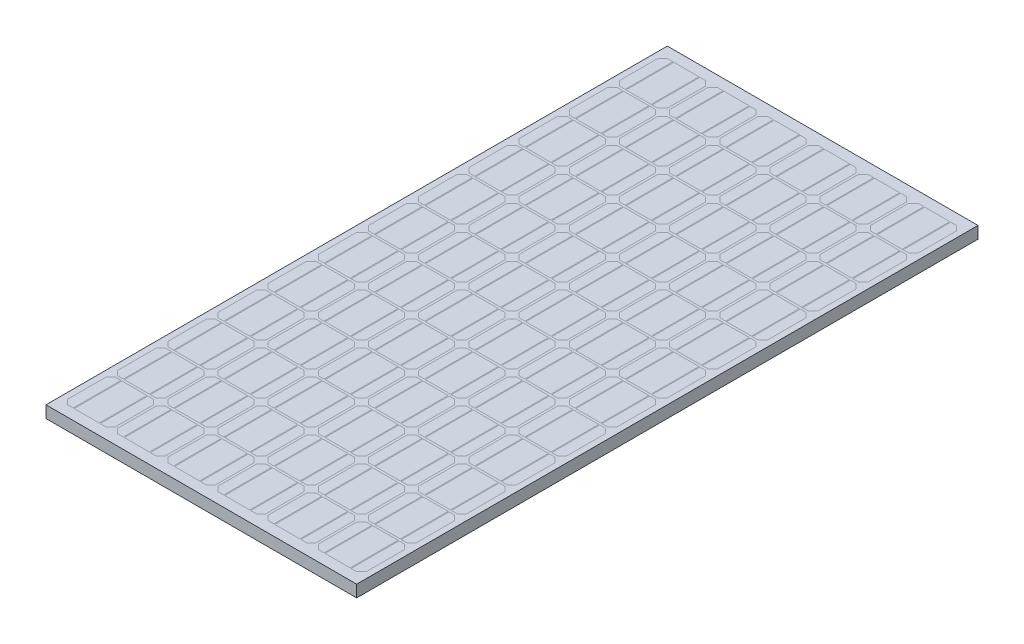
SolidWorks part; units mm, degrees
ref_plane "Front Plane" through (0, 0, 0) normal (0, 0, 1) x (1, 0, 0)
ref_plane "Top Plane" through (0, 0, 0) normal (0, 1, 0) x (1, 0, 0)
ref_plane "Right Plane" through (0, 0, 0) normal (1, 0, 0) x (0, 0, -1)
sketch "Sketch1" plane through (0, 0, 0) normal (0, 1, 0) x (1, 0, 0)
  line L1 (495.3, -990.6) -> (-495.3, -990.6)
  line L2 (495.3, -990.6) -> (495.3, 990.6)
  line L3 (495.3, 990.6) -> (-495.3, 990.6)
  line L4 (-495.3, -990.6) -> (-495.3, 990.6)
  line L5 (495.3, -990.6) -> (-495.3, 990.6) construction
  line L6 (495.3, 990.6) -> (-495.3, -990.6) construction
  point P0 (0, 0)
  dimension "D1" = 1981.2
  dimension "D2" = 990.6
extrude "Boss-Extrude1" add sketch "Sketch1" along normal blind 38.1
sketch "Sketch2" plane through (0, 38.1, 0) normal (0, 1, 0) x (1, 0, 0)
  line L0 (-495.3, 990.6) -> (-495.3, -990.6) construction
  line L1 (-461.2, 956.2) -> (-443, 956.2)
  line L2 (-476.2, 941.2) -> (-476.2, 818.8)
  line L3 (-461.2, 803.8) -> (-443, 803.8)
  line L4 (-323.8, 941.2) -> (-323.8, 818.8)
  line L5 (-476.2, 956.2) -> (-323.8, 803.8) construction
  line L6 (-476.2, 803.8) -> (-323.8, 956.2) construction
  line L7 (495.3, 990.6) -> (-495.3, 990.6) construction
  line L8 (-476.2, 941.2) -> (-461.2, 956.2)
  line L9 (-338.8, 956.2) -> (-323.8, 941.2)
  line L10 (-476.2, 818.8) -> (-461.2, 803.8)
  line L11 (-338.8, 803.8) -> (-323.8, 818.8)
  line L20 (-301.2, 956.2) -> (-283, 956.2)
  line L21 (-316.2, 941.2) -> (-316.2, 818.8)
  line L30 (-301.2, 803.8) -> (-283, 803.8)
  line L31 (-163.8, 941.2) -> (-163.8, 818.8)
  line L40 (-316.2, 941.2) -> (-301.2, 956.2)
  line L41 (-178.8, 956.2) -> (-163.8, 941.2)
  line L50 (-316.2, 818.8) -> (-301.2, 803.8)
  line L51 (-178.8, 803.8) -> (-163.8, 818.8)
  line L60 (-283, 956.2) -> (-283, 803.8)
  line L61 (-280, 956.2) -> (-280, 803.8)
  line L110 (-200, 956.2) -> (-200, 803.8)
  line L111 (-197, 956.2) -> (-197, 803.8)
  line L112 (-280, 956.2) -> (-200, 956.2)
  line L113 (-197, 956.2) -> (-178.8, 956.2)
  line L114 (-280, 803.8) -> (-200, 803.8)
  line L115 (-197, 803.8) -> (-178.8, 803.8)
  line L116 (-316.2, 956.2) -> (-163.8, 803.8) construction
  line L117 (-316.2, 803.8) -> (-163.8, 956.2) construction
  line L118 (-240, 956.2) -> (-240, 803.8) construction
  line L119 (-141.2, 956.2) -> (-123, 956.2)
  line L120 (-156.2, 941.2) -> (-156.2, 818.8)
  line L121 (-141.2, 803.8) -> (-123, 803.8)
  line L170 (-3.8, 941.2) -> (-3.8, 818.8)
  line L171 (-156.2, 941.2) -> (-141.2, 956.2)
  line L172 (-18.8, 956.2) -> (-3.8, 941.2)
  line L173 (-156.2, 818.8) -> (-141.2, 803.8)
  line L174 (-18.8, 803.8) -> (-3.8, 818.8)
  line L175 (-123, 956.2) -> (-123, 803.8)
  line L176 (-120, 956.2) -> (-120, 803.8)
  line L177 (-40, 956.2) -> (-40, 803.8)
  line L178 (-37, 956.2) -> (-37, 803.8)
  line L179 (-120, 956.2) -> (-40, 956.2)
  line L180 (-37, 956.2) -> (-18.8, 956.2)
  line L181 (-120, 803.8) -> (-40, 803.8)
  line L230 (-37, 803.8) -> (-18.8, 803.8)
  line L231 (-156.2, 956.2) -> (-3.8, 803.8) construction
  line L232 (-156.2, 803.8) -> (-3.8, 956.2) construction
  line L233 (-80, 956.2) -> (-80, 803.8) construction
  line L234 (18.8, 956.2) -> (37, 956.2)
  line L235 (3.8, 941.2) -> (3.8, 818.8)
  line L236 (18.8, 803.8) -> (37, 803.8)
  line L237 (156.2, 941.2) -> (156.2, 818.8)
  line L238 (3.8, 941.2) -> (18.8, 956.2)
  line L239 (141.2, 956.2) -> (156.2, 941.2)
  line L240 (3.8, 818.8) -> (18.8, 803.8)
  line L241 (141.2, 803.8) -> (156.2, 818.8)
  line L290 (37, 956.2) -> (37, 803.8)
  line L291 (40, 956.2) -> (40, 803.8)
  line L292 (120, 956.2) -> (120, 803.8)
  line L293 (123, 956.2) -> (123, 803.8)
  line L294 (40, 956.2) -> (120, 956.2)
  line L295 (123, 956.2) -> (141.2, 956.2)
  line L296 (40, 803.8) -> (120, 803.8)
  line L297 (123, 803.8) -> (141.2, 803.8)
  line L298 (3.8, 956.2) -> (156.2, 803.8) construction
  line L299 (3.8, 803.8) -> (156.2, 956.2) construction
  line L300 (80, 956.2) -> (80, 803.8) construction
  line L301 (178.8, 956.2) -> (197, 956.2)
  line L350 (163.8, 941.2) -> (163.8, 818.8)
  line L351 (178.8, 803.8) -> (197, 803.8)
  line L352 (316.2, 941.2) -> (316.2, 818.8)
  line L353 (163.8, 941.2) -> (178.8, 956.2)
  line L354 (301.2, 956.2) -> (316.2, 941.2)
  line L355 (163.8, 818.8) -> (178.8, 803.8)
  line L356 (301.2, 803.8) -> (316.2, 818.8)
  line L357 (197, 956.2) -> (197, 803.8)
  line L358 (200, 956.2) -> (200, 803.8)
  line L359 (280, 956.2) -> (280, 803.8)
  line L360 (283, 956.2) -> (283, 803.8)
  line L361 (200, 956.2) -> (280, 956.2)
  line L410 (283, 956.2) -> (301.2, 956.2)
  line L411 (200, 803.8) -> (280, 803.8)
  line L412 (283, 803.8) -> (301.2, 803.8)
  line L413 (163.8, 956.2) -> (316.2, 803.8) construction
  line L414 (163.8, 803.8) -> (316.2, 956.2) construction
  line L415 (240, 956.2) -> (240, 803.8) construction
  line L416 (338.8, 956.2) -> (357, 956.2)
  line L417 (323.8, 941.2) -> (323.8, 818.8)
  line L418 (338.8, 803.8) -> (357, 803.8)
  line L419 (476.2, 941.2) -> (476.2, 818.8)
  line L420 (323.8, 941.2) -> (338.8, 956.2)
  line L421 (461.2, 956.2) -> (476.2, 941.2)
  line L470 (323.8, 818.8) -> (338.8, 803.8)
  line L471 (461.2, 803.8) -> (476.2, 818.8)
  line L472 (357, 956.2) -> (357, 803.8)
  line L473 (360, 956.2) -> (360, 803.8)
  line L474 (440, 956.2) -> (440, 803.8)
  line L475 (443, 956.2) -> (443, 803.8)
  line L476 (360, 956.2) -> (440, 956.2)
  line L477 (443, 956.2) -> (461.2, 956.2)
  line L478 (360, 803.8) -> (440, 803.8)
  line L479 (443, 803.8) -> (461.2, 803.8)
  line L480 (323.8, 956.2) -> (476.2, 803.8) construction
  line L481 (323.8, 803.8) -> (476.2, 956.2) construction
  line L530 (400, 956.2) -> (400, 803.8) construction
  line L531 (-461.2, 796.2) -> (-443, 796.2)
  line L532 (-476.2, 781.2) -> (-476.2, 658.8)
  line L533 (-461.2, 643.8) -> (-443, 643.8)
  line L534 (-323.8, 781.2) -> (-323.8, 658.8)
  line L535 (-476.2, 781.2) -> (-461.2, 796.2)
  line L536 (-338.8, 796.2) -> (-323.8, 781.2)
  line L537 (-476.2, 658.8) -> (-461.2, 643.8)
  line L538 (-338.8, 643.8) -> (-323.8, 658.8)
  line L539 (-301.2, 796.2) -> (-283, 796.2)
  line L540 (-316.2, 781.2) -> (-316.2, 658.8)
  line L541 (-301.2, 643.8) -> (-283, 643.8)
  line L590 (-163.8, 781.2) -> (-163.8, 658.8)
  line L591 (-316.2, 781.2) -> (-301.2, 796.2)
  line L592 (-178.8, 796.2) -> (-163.8, 781.2)
  line L593 (-316.2, 658.8) -> (-301.2, 643.8)
  line L594 (-178.8, 643.8) -> (-163.8, 658.8)
  line L595 (-283, 796.2) -> (-283, 643.8)
  line L596 (-280, 796.2) -> (-280, 643.8)
  line L597 (-200, 796.2) -> (-200, 643.8)
  line L598 (-197, 796.2) -> (-197, 643.8)
  line L599 (-280, 796.2) -> (-200, 796.2)
  line L600 (-197, 796.2) -> (-178.8, 796.2)
  line L601 (-280, 643.8) -> (-200, 643.8)
  line L650 (-197, 643.8) -> (-178.8, 643.8)
  line L651 (-141.2, 796.2) -> (-123, 796.2)
  line L652 (-156.2, 781.2) -> (-156.2, 658.8)
  line L653 (-141.2, 643.8) -> (-123, 643.8)
  line L654 (-3.8, 781.2) -> (-3.8, 658.8)
  line L655 (-156.2, 781.2) -> (-141.2, 796.2)
  line L656 (-18.8, 796.2) -> (-3.8, 781.2)
  line L657 (-156.2, 658.8) -> (-141.2, 643.8)
  line L658 (-18.8, 643.8) -> (-3.8, 658.8)
  line L659 (-123, 796.2) -> (-123, 643.8)
  line L660 (-120, 796.2) -> (-120, 643.8)
  line L661 (-40, 796.2) -> (-40, 643.8)
  line L710 (-37, 796.2) -> (-37, 643.8)
  line L711 (-120, 796.2) -> (-40, 796.2)
  line L712 (-37, 796.2) -> (-18.8, 796.2)
  line L713 (-120, 643.8) -> (-40, 643.8)
  line L714 (-37, 643.8) -> (-18.8, 643.8)
  line L715 (18.8, 796.2) -> (37, 796.2)
  line L716 (3.8, 781.2) -> (3.8, 658.8)
  line L717 (18.8, 643.8) -> (37, 643.8)
  line L718 (156.2, 781.2) -> (156.2, 658.8)
  line L719 (3.8, 781.2) -> (18.8, 796.2)
  line L720 (141.2, 796.2) -> (156.2, 781.2)
  line L721 (3.8, 658.8) -> (18.8, 643.8)
  line L722 (-400, 956.2) -> (-400, 803.8) construction
  line L724 (-443, 956.2) -> (-443, 803.8)
  line L726 (-440, 956.2) -> (-440, 803.8)
  line L727 (-360, 956.2) -> (-360, 803.8)
  line L728 (-357, 956.2) -> (-357, 803.8)
  line L729 (-440, 956.2) -> (-360, 956.2)
  line L730 (-357, 956.2) -> (-338.8, 956.2)
  line L731 (-440, 803.8) -> (-360, 803.8)
  line L732 (-357, 803.8) -> (-338.8, 803.8)
  line L733 (141.2, 643.8) -> (156.2, 658.8)
  line L734 (37, 796.2) -> (37, 643.8)
  line L735 (40, 796.2) -> (40, 643.8)
  line L736 (120, 796.2) -> (120, 643.8)
  line L737 (123, 796.2) -> (123, 643.8)
  line L738 (40, 796.2) -> (120, 796.2)
  line L739 (123, 796.2) -> (141.2, 796.2)
  line L740 (40, 643.8) -> (120, 643.8)
  line L741 (123, 643.8) -> (141.2, 643.8)
  line L742 (178.8, 796.2) -> (197, 796.2)
  line L743 (163.8, 781.2) -> (163.8, 658.8)
  line L744 (178.8, 643.8) -> (197, 643.8)
  line L745 (316.2, 781.2) -> (316.2, 658.8)
  line L746 (163.8, 781.2) -> (178.8, 796.2)
  line L747 (301.2, 796.2) -> (316.2, 781.2)
  line L748 (163.8, 658.8) -> (178.8, 643.8)
  line L749 (301.2, 643.8) -> (316.2, 658.8)
  line L750 (197, 796.2) -> (197, 643.8)
  line L751 (200, 796.2) -> (200, 643.8)
  line L752 (280, 796.2) -> (280, 643.8)
  line L753 (283, 796.2) -> (283, 643.8)
  line L754 (200, 796.2) -> (280, 796.2)
  line L755 (283, 796.2) -> (301.2, 796.2)
  line L756 (200, 643.8) -> (280, 643.8)
  line L757 (283, 643.8) -> (301.2, 643.8)
  line L758 (338.8, 796.2) -> (357, 796.2)
  line L759 (323.8, 781.2) -> (323.8, 658.8)
  line L760 (338.8, 643.8) -> (357, 643.8)
  line L761 (476.2, 781.2) -> (476.2, 658.8)
  line L762 (323.8, 781.2) -> (338.8, 796.2)
  line L763 (461.2, 796.2) -> (476.2, 781.2)
  line L764 (323.8, 658.8) -> (338.8, 643.8)
  line L765 (461.2, 643.8) -> (476.2, 658.8)
  line L766 (357, 796.2) -> (357, 643.8)
  line L767 (360, 796.2) -> (360, 643.8)
  line L768 (440, 796.2) -> (440, 643.8)
  line L769 (443, 796.2) -> (443, 643.8)
  line L770 (360, 796.2) -> (440, 796.2)
  line L771 (443, 796.2) -> (461.2, 796.2)
  line L772 (360, 643.8) -> (440, 643.8)
  line L773 (443, 643.8) -> (461.2, 643.8)
  line L774 (-443, 796.2) -> (-443, 643.8)
  line L775 (-440, 796.2) -> (-440, 643.8)
  line L776 (-360, 796.2) -> (-360, 643.8)
  line L777 (-357, 796.2) -> (-357, 643.8)
  line L778 (-440, 796.2) -> (-360, 796.2)
  line L779 (-357, 796.2) -> (-338.8, 796.2)
  line L780 (-440, 643.8) -> (-360, 643.8)
  line L784 (-357, 643.8) -> (-338.8, 643.8)
  line L785 (-476.2, 796.2) -> (-323.8, 643.8) construction
  line L786 (-476.2, 643.8) -> (-323.8, 796.2) construction
  line L787 (-316.2, 796.2) -> (-163.8, 643.8) construction
  line L788 (-316.2, 643.8) -> (-163.8, 796.2) construction
  line L789 (-240, 796.2) -> (-240, 643.8) construction
  line L790 (-156.2, 796.2) -> (-3.8, 643.8) construction
  line L791 (-156.2, 643.8) -> (-3.8, 796.2) construction
  line L797 (-80, 796.2) -> (-80, 643.8) construction
  line L798 (3.8, 796.2) -> (156.2, 643.8) construction
  line L799 (3.8, 643.8) -> (156.2, 796.2) construction
  line L800 (80, 796.2) -> (80, 643.8) construction
  line L801 (163.8, 796.2) -> (316.2, 643.8) construction
  line L802 (163.8, 643.8) -> (316.2, 796.2) construction
  line L803 (240, 796.2) -> (240, 643.8) construction
  line L804 (323.8, 796.2) -> (476.2, 643.8) construction
  line L810 (323.8, 643.8) -> (476.2, 796.2) construction
  line L811 (400, 796.2) -> (400, 643.8) construction
  line L812 (-400, 796.2) -> (-400, 643.8) construction
  line L813 (-461.2, 636.2) -> (-443, 636.2)
  line L814 (-476.2, 621.2) -> (-476.2, 498.8)
  line L815 (-461.2, 483.8) -> (-443, 483.8)
  line L816 (-323.8, 621.2) -> (-323.8, 498.8)
  line L817 (-476.2, 621.2) -> (-461.2, 636.2)
  line L823 (-338.8, 636.2) -> (-323.8, 621.2)
  line L824 (-476.2, 498.8) -> (-461.2, 483.8)
  line L825 (-338.8, 483.8) -> (-323.8, 498.8)
  line L826 (-301.2, 636.2) -> (-283, 636.2)
  line L827 (-316.2, 621.2) -> (-316.2, 498.8)
  line L828 (-301.2, 483.8) -> (-283, 483.8)
  line L829 (-163.8, 621.2) -> (-163.8, 498.8)
  line L830 (-316.2, 621.2) -> (-301.2, 636.2)
  line L836 (-178.8, 636.2) -> (-163.8, 621.2)
  line L837 (-316.2, 498.8) -> (-301.2, 483.8)
  line L838 (-178.8, 483.8) -> (-163.8, 498.8)
  line L839 (-283, 636.2) -> (-283, 483.8)
  line L840 (-280, 636.2) -> (-280, 483.8)
  line L841 (-200, 636.2) -> (-200, 483.8)
  line L842 (-197, 636.2) -> (-197, 483.8)
  line L843 (-280, 636.2) -> (-200, 636.2)
  line L849 (-197, 636.2) -> (-178.8, 636.2)
  line L850 (-280, 483.8) -> (-200, 483.8)
  line L851 (-197, 483.8) -> (-178.8, 483.8)
  line L852 (-141.2, 636.2) -> (-123, 636.2)
  line L853 (-156.2, 621.2) -> (-156.2, 498.8)
  line L854 (-141.2, 483.8) -> (-123, 483.8)
  line L855 (-3.8, 621.2) -> (-3.8, 498.8)
  line L856 (-156.2, 621.2) -> (-141.2, 636.2)
  line L862 (-18.8, 636.2) -> (-3.8, 621.2)
  line L863 (-156.2, 498.8) -> (-141.2, 483.8)
  line L864 (-18.8, 483.8) -> (-3.8, 498.8)
  line L865 (-123, 636.2) -> (-123, 483.8)
  line L866 (-120, 636.2) -> (-120, 483.8)
  line L867 (-40, 636.2) -> (-40, 483.8)
  line L868 (-37, 636.2) -> (-37, 483.8)
  line L869 (-120, 636.2) -> (-40, 636.2)
  line L875 (-37, 636.2) -> (-18.8, 636.2)
  line L876 (-120, 483.8) -> (-40, 483.8)
  line L877 (-37, 483.8) -> (-18.8, 483.8)
  line L878 (18.8, 636.2) -> (37, 636.2)
  line L879 (3.8, 621.2) -> (3.8, 498.8)
  line L880 (18.8, 483.8) -> (37, 483.8)
  line L881 (156.2, 621.2) -> (156.2, 498.8)
  line L882 (3.8, 621.2) -> (18.8, 636.2)
  line L888 (141.2, 636.2) -> (156.2, 621.2)
  line L889 (3.8, 498.8) -> (18.8, 483.8)
  line L890 (141.2, 483.8) -> (156.2, 498.8)
  line L891 (37, 636.2) -> (37, 483.8)
  line L892 (40, 636.2) -> (40, 483.8)
  line L893 (120, 636.2) -> (120, 483.8)
  line L894 (123, 636.2) -> (123, 483.8)
  line L895 (40, 636.2) -> (120, 636.2)
  line L901 (123, 636.2) -> (141.2, 636.2)
  line L902 (40, 483.8) -> (120, 483.8)
  line L903 (123, 483.8) -> (141.2, 483.8)
  line L904 (178.8, 636.2) -> (197, 636.2)
  line L905 (163.8, 621.2) -> (163.8, 498.8)
  line L906 (178.8, 483.8) -> (197, 483.8)
  line L907 (316.2, 621.2) -> (316.2, 498.8)
  line L908 (163.8, 621.2) -> (178.8, 636.2)
  line L914 (301.2, 636.2) -> (316.2, 621.2)
  line L915 (163.8, 498.8) -> (178.8, 483.8)
  line L918 (301.2, 483.8) -> (316.2, 498.8)
  line L919 (197, 636.2) -> (197, 483.8)
  line L922 (200, 636.2) -> (200, 483.8)
  line L923 (280, 636.2) -> (280, 483.8)
  line L926 (283, 636.2) -> (283, 483.8)
  line L927 (200, 636.2) -> (280, 636.2)
  line L930 (283, 636.2) -> (301.2, 636.2)
  line L931 (200, 483.8) -> (280, 483.8)
  line L934 (283, 483.8) -> (301.2, 483.8)
  line L935 (338.8, 636.2) -> (357, 636.2)
  line L938 (323.8, 621.2) -> (323.8, 498.8)
  line L939 (338.8, 483.8) -> (357, 483.8)
  line L942 (476.2, 621.2) -> (476.2, 498.8)
  line L943 (323.8, 621.2) -> (338.8, 636.2)
  line L946 (461.2, 636.2) -> (476.2, 621.2)
  line L947 (323.8, 498.8) -> (338.8, 483.8)
  line L950 (461.2, 483.8) -> (476.2, 498.8)
  line L951 (357, 636.2) -> (357, 483.8)
  line L954 (360, 636.2) -> (360, 483.8)
  line L955 (440, 636.2) -> (440, 483.8)
  line L958 (443, 636.2) -> (443, 483.8)
  line L959 (360, 636.2) -> (440, 636.2)
  line L960 (443, 636.2) -> (461.2, 636.2)
  line L961 (360, 483.8) -> (440, 483.8)
  line L962 (443, 483.8) -> (461.2, 483.8)
  line L963 (-443, 636.2) -> (-443, 483.8)
  line L964 (-440, 636.2) -> (-440, 483.8)
  line L965 (-360, 636.2) -> (-360, 483.8)
  line L966 (-357, 636.2) -> (-357, 483.8)
  line L967 (-440, 636.2) -> (-360, 636.2)
  line L968 (-357, 636.2) -> (-338.8, 636.2)
  line L969 (-440, 483.8) -> (-360, 483.8)
  line L970 (-357, 483.8) -> (-338.8, 483.8)
  line L971 (-476.2, 636.2) -> (-323.8, 483.8) construction
  line L972 (-476.2, 483.8) -> (-323.8, 636.2) construction
  line L973 (-316.2, 636.2) -> (-163.8, 483.8) construction
  line L974 (-316.2, 483.8) -> (-163.8, 636.2) construction
  line L975 (-240, 636.2) -> (-240, 483.8) construction
  line L976 (-156.2, 636.2) -> (-3.8, 483.8) construction
  line L977 (-156.2, 483.8) -> (-3.8, 636.2) construction
  line L978 (-80, 636.2) -> (-80, 483.8) construction
  line L979 (3.8, 636.2) -> (156.2, 483.8) construction
  line L980 (3.8, 483.8) -> (156.2, 636.2) construction
  line L981 (80, 636.2) -> (80, 483.8) construction
  line L982 (163.8, 636.2) -> (316.2, 483.8) construction
  line L983 (163.8, 483.8) -> (316.2, 636.2) construction
  line L984 (240, 636.2) -> (240, 483.8) construction
  line L985 (323.8, 636.2) -> (476.2, 483.8) construction
  line L986 (323.8, 483.8) -> (476.2, 636.2) construction
  line L987 (400, 636.2) -> (400, 483.8) construction
  line L988 (-400, 636.2) -> (-400, 483.8) construction
  line L989 (-461.2, 476.2) -> (-443, 476.2)
  line L990 (-476.2, 461.2) -> (-476.2, 338.8)
  line L991 (-461.2, 323.8) -> (-443, 323.8)
  line L992 (-323.8, 461.2) -> (-323.8, 338.8)
  line L993 (-476.2, 461.2) -> (-461.2, 476.2)
  line L994 (-338.8, 476.2) -> (-323.8, 461.2)
  line L995 (-476.2, 338.8) -> (-461.2, 323.8)
  line L996 (-338.8, 323.8) -> (-323.8, 338.8)
  line L997 (-301.2, 476.2) -> (-283, 476.2)
  line L998 (-316.2, 461.2) -> (-316.2, 338.8)
  line L999 (-301.2, 323.8) -> (-283, 323.8)
  line L1000 (-163.8, 461.2) -> (-163.8, 338.8)
  line L1001 (-316.2, 461.2) -> (-301.2, 476.2)
  line L1002 (-178.8, 476.2) -> (-163.8, 461.2)
  line L1003 (-316.2, 338.8) -> (-301.2, 323.8)
  line L1004 (-178.8, 323.8) -> (-163.8, 338.8)
  line L1005 (-283, 476.2) -> (-283, 323.8)
  line L1006 (-280, 476.2) -> (-280, 323.8)
  line L1007 (-200, 476.2) -> (-200, 323.8)
  line L1008 (-197, 476.2) -> (-197, 323.8)
  line L1009 (-280, 476.2) -> (-200, 476.2)
  line L1010 (-197, 476.2) -> (-178.8, 476.2)
  line L1011 (-280, 323.8) -> (-200, 323.8)
  line L1012 (-197, 323.8) -> (-178.8, 323.8)
  line L1013 (-141.2, 476.2) -> (-123, 476.2)
  line L1014 (-156.2, 461.2) -> (-156.2, 338.8)
  line L1015 (-141.2, 323.8) -> (-123, 323.8)
  line L1016 (-3.8, 461.2) -> (-3.8, 338.8)
  line L1017 (-156.2, 461.2) -> (-141.2, 476.2)
  line L1018 (-18.8, 476.2) -> (-3.8, 461.2)
  line L1019 (-156.2, 338.8) -> (-141.2, 323.8)
  line L1020 (-18.8, 323.8) -> (-3.8, 338.8)
  line L1021 (-123, 476.2) -> (-123, 323.8)
  line L1022 (-120, 476.2) -> (-120, 323.8)
  line L1023 (-40, 476.2) -> (-40, 323.8)
  line L1024 (-37, 476.2) -> (-37, 323.8)
  line L1025 (-120, 476.2) -> (-40, 476.2)
  line L1026 (-37, 476.2) -> (-18.8, 476.2)
  line L1027 (-120, 323.8) -> (-40, 323.8)
  line L1028 (-37, 323.8) -> (-18.8, 323.8)
  line L1029 (18.8, 476.2) -> (37, 476.2)
  line L1030 (3.8, 461.2) -> (3.8, 338.8)
  line L1031 (18.8, 323.8) -> (37, 323.8)
  line L1032 (156.2, 461.2) -> (156.2, 338.8)
  line L1033 (3.8, 461.2) -> (18.8, 476.2)
  line L1034 (141.2, 476.2) -> (156.2, 461.2)
  line L1035 (3.8, 338.8) -> (18.8, 323.8)
  line L1036 (141.2, 323.8) -> (156.2, 338.8)
  line L1037 (37, 476.2) -> (37, 323.8)
  line L1038 (40, 476.2) -> (40, 323.8)
  line L1039 (120, 476.2) -> (120, 323.8)
  line L1040 (123, 476.2) -> (123, 323.8)
  line L1041 (40, 476.2) -> (120, 476.2)
  line L1042 (123, 476.2) -> (141.2, 476.2)
  line L1043 (40, 323.8) -> (120, 323.8)
  line L1044 (123, 323.8) -> (141.2, 323.8)
  line L1045 (178.8, 476.2) -> (197, 476.2)
  line L1046 (163.8, 461.2) -> (163.8, 338.8)
  line L1047 (178.8, 323.8) -> (197, 323.8)
  line L1048 (316.2, 461.2) -> (316.2, 338.8)
  line L1049 (163.8, 461.2) -> (178.8, 476.2)
  line L1050 (301.2, 476.2) -> (316.2, 461.2)
  line L1051 (163.8, 338.8) -> (178.8, 323.8)
  line L1052 (301.2, 323.8) -> (316.2, 338.8)
  line L1053 (197, 476.2) -> (197, 323.8)
  line L1054 (200, 476.2) -> (200, 323.8)
  line L1055 (280, 476.2) -> (280, 323.8)
  line L1056 (283, 476.2) -> (283, 323.8)
  line L1057 (200, 476.2) -> (280, 476.2)
  line L1058 (283, 476.2) -> (301.2, 476.2)
  line L1059 (200, 323.8) -> (280, 323.8)
  line L1060 (283, 323.8) -> (301.2, 323.8)
  line L1061 (338.8, 476.2) -> (357, 476.2)
  line L1062 (323.8, 461.2) -> (323.8, 338.8)
  line L1063 (338.8, 323.8) -> (357, 323.8)
  line L1064 (476.2, 461.2) -> (476.2, 338.8)
  line L1065 (323.8, 461.2) -> (338.8, 476.2)
  line L1066 (461.2, 476.2) -> (476.2, 461.2)
  line L1067 (323.8, 338.8) -> (338.8, 323.8)
  line L1068 (461.2, 323.8) -> (476.2, 338.8)
  line L1069 (357, 476.2) -> (357, 323.8)
  line L1070 (360, 476.2) -> (360, 323.8)
  line L1071 (440, 476.2) -> (440, 323.8)
  line L1072 (443, 476.2) -> (443, 323.8)
  line L1073 (360, 476.2) -> (440, 476.2)
  line L1074 (443, 476.2) -> (461.2, 476.2)
  line L1075 (360, 323.8) -> (440, 323.8)
  line L1076 (443, 323.8) -> (461.2, 323.8)
  line L1077 (-443, 476.2) -> (-443, 323.8)
  line L1078 (-440, 476.2) -> (-440, 323.8)
  line L1079 (-360, 476.2) -> (-360, 323.8)
  line L1080 (-357, 476.2) -> (-357, 323.8)
  line L1081 (-440, 476.2) -> (-360, 476.2)
  line L1082 (-357, 476.2) -> (-338.8, 476.2)
  line L1083 (-440, 323.8) -> (-360, 323.8)
  line L1084 (-357, 323.8) -> (-338.8, 323.8)
  line L1085 (-476.2, 476.2) -> (-323.8, 323.8) construction
  line L1086 (-476.2, 323.8) -> (-323.8, 476.2) construction
  line L1087 (-316.2, 476.2) -> (-163.8, 323.8) construction
  line L1088 (-316.2, 323.8) -> (-163.8, 476.2) construction
  line L1089 (-240, 476.2) -> (-240, 323.8) construction
  line L1090 (-156.2, 476.2) -> (-3.8, 323.8) construction
  line L1091 (-156.2, 323.8) -> (-3.8, 476.2) construction
  line L1092 (-80, 476.2) -> (-80, 323.8) construction
  line L1093 (3.8, 476.2) -> (156.2, 323.8) construction
  line L1094 (3.8, 323.8) -> (156.2, 476.2) construction
  line L1095 (80, 476.2) -> (80, 323.8) construction
  line L1096 (163.8, 476.2) -> (316.2, 323.8) construction
  line L1097 (163.8, 323.8) -> (316.2, 476.2) construction
  line L1098 (240, 476.2) -> (240, 323.8) construction
  line L1099 (323.8, 476.2) -> (476.2, 323.8) construction
  line L1100 (323.8, 323.8) -> (476.2, 476.2) construction
  line L1101 (400, 476.2) -> (400, 323.8) construction
  line L1102 (-400, 476.2) -> (-400, 323.8) construction
  line L1103 (-461.2, 316.2) -> (-443, 316.2)
  line L1104 (-476.2, 301.2) -> (-476.2, 178.8)
  line L1105 (-461.2, 163.8) -> (-443, 163.8)
  line L1106 (-323.8, 301.2) -> (-323.8, 178.8)
  line L1107 (-476.2, 301.2) -> (-461.2, 316.2)
  line L1108 (-338.8, 316.2) -> (-323.8, 301.2)
  line L1109 (-476.2, 178.8) -> (-461.2, 163.8)
  line L1110 (-338.8, 163.8) -> (-323.8, 178.8)
  line L1111 (-301.2, 316.2) -> (-283, 316.2)
  line L1112 (-316.2, 301.2) -> (-316.2, 178.8)
  line L1113 (-301.2, 163.8) -> (-283, 163.8)
  line L1114 (-163.8, 301.2) -> (-163.8, 178.8)
  line L1115 (-316.2, 301.2) -> (-301.2, 316.2)
  line L1116 (-178.8, 316.2) -> (-163.8, 301.2)
  line L1117 (-316.2, 178.8) -> (-301.2, 163.8)
  line L1118 (-178.8, 163.8) -> (-163.8, 178.8)
  line L1119 (-283, 316.2) -> (-283, 163.8)
  line L1120 (-280, 316.2) -> (-280, 163.8)
  line L1121 (-200, 316.2) -> (-200, 163.8)
  line L1122 (-197, 316.2) -> (-197, 163.8)
  line L1123 (-280, 316.2) -> (-200, 316.2)
  line L1124 (-197, 316.2) -> (-178.8, 316.2)
  line L1125 (-280, 163.8) -> (-200, 163.8)
  line L1126 (-197, 163.8) -> (-178.8, 163.8)
  line L1127 (-141.2, 316.2) -> (-123, 316.2)
  line L1128 (-156.2, 301.2) -> (-156.2, 178.8)
  line L1129 (-141.2, 163.8) -> (-123, 163.8)
  line L1130 (-3.8, 301.2) -> (-3.8, 178.8)
  line L1131 (-156.2, 301.2) -> (-141.2, 316.2)
  line L1132 (-18.8, 316.2) -> (-3.8, 301.2)
  line L1133 (-156.2, 178.8) -> (-141.2, 163.8)
  line L1134 (-18.8, 163.8) -> (-3.8, 178.8)
  line L1135 (-123, 316.2) -> (-123, 163.8)
  line L1136 (-120, 316.2) -> (-120, 163.8)
  line L1137 (-40, 316.2) -> (-40, 163.8)
  line L1138 (-37, 316.2) -> (-37, 163.8)
  line L1139 (-120, 316.2) -> (-40, 316.2)
  line L1140 (-37, 316.2) -> (-18.8, 316.2)
  line L1141 (-120, 163.8) -> (-40, 163.8)
  line L1142 (-37, 163.8) -> (-18.8, 163.8)
  line L1143 (18.8, 316.2) -> (37, 316.2)
  line L1144 (3.8, 301.2) -> (3.8, 178.8)
  line L1145 (18.8, 163.8) -> (37, 163.8)
  line L1146 (156.2, 301.2) -> (156.2, 178.8)
  line L1147 (3.8, 301.2) -> (18.8, 316.2)
  line L1148 (141.2, 316.2) -> (156.2, 301.2)
  line L1149 (3.8, 178.8) -> (18.8, 163.8)
  line L1150 (141.2, 163.8) -> (156.2, 178.8)
  line L1151 (37, 316.2) -> (37, 163.8)
  line L1152 (40, 316.2) -> (40, 163.8)
  line L1153 (120, 316.2) -> (120, 163.8)
  line L1154 (123, 316.2) -> (123, 163.8)
  line L1155 (40, 316.2) -> (120, 316.2)
  line L1156 (123, 316.2) -> (141.2, 316.2)
  line L1157 (40, 163.8) -> (120, 163.8)
  line L1158 (123, 163.8) -> (141.2, 163.8)
  line L1159 (178.8, 316.2) -> (197, 316.2)
  line L1160 (163.8, 301.2) -> (163.8, 178.8)
  line L1161 (178.8, 163.8) -> (197, 163.8)
  line L1162 (316.2, 301.2) -> (316.2, 178.8)
  line L1163 (163.8, 301.2) -> (178.8, 316.2)
  line L1164 (301.2, 316.2) -> (316.2, 301.2)
  line L1165 (163.8, 178.8) -> (178.8, 163.8)
  line L1166 (301.2, 163.8) -> (316.2, 178.8)
  line L1167 (197, 316.2) -> (197, 163.8)
  line L1168 (200, 316.2) -> (200, 163.8)
  line L1169 (280, 316.2) -> (280, 163.8)
  line L1170 (283, 316.2) -> (283, 163.8)
  line L1171 (200, 316.2) -> (280, 316.2)
  line L1172 (283, 316.2) -> (301.2, 316.2)
  line L1173 (200, 163.8) -> (280, 163.8)
  line L1174 (283, 163.8) -> (301.2, 163.8)
  line L1175 (338.8, 316.2) -> (357, 316.2)
  line L1176 (323.8, 301.2) -> (323.8, 178.8)
  line L1177 (338.8, 163.8) -> (357, 163.8)
  line L1178 (476.2, 301.2) -> (476.2, 178.8)
  line L1179 (323.8, 301.2) -> (338.8, 316.2)
  line L1180 (461.2, 316.2) -> (476.2, 301.2)
  line L1181 (323.8, 178.8) -> (338.8, 163.8)
  line L1182 (461.2, 163.8) -> (476.2, 178.8)
  line L1183 (357, 316.2) -> (357, 163.8)
  line L1184 (360, 316.2) -> (360, 163.8)
  line L1185 (440, 316.2) -> (440, 163.8)
  line L1186 (443, 316.2) -> (443, 163.8)
  line L1187 (360, 316.2) -> (440, 316.2)
  line L1188 (443, 316.2) -> (461.2, 316.2)
  line L1189 (360, 163.8) -> (440, 163.8)
  line L1190 (443, 163.8) -> (461.2, 163.8)
  line L1191 (-443, 316.2) -> (-443, 163.8)
  line L1192 (-440, 316.2) -> (-440, 163.8)
  line L1193 (-360, 316.2) -> (-360, 163.8)
  line L1194 (-357, 316.2) -> (-357, 163.8)
  line L1195 (-440, 316.2) -> (-360, 316.2)
  line L1196 (-357, 316.2) -> (-338.8, 316.2)
  line L1197 (-440, 163.8) -> (-360, 163.8)
  line L1198 (-357, 163.8) -> (-338.8, 163.8)
  line L1199 (-476.2, 316.2) -> (-323.8, 163.8) construction
  line L1200 (-476.2, 163.8) -> (-323.8, 316.2) construction
  line L1201 (-316.2, 316.2) -> (-163.8, 163.8) construction
  line L1202 (-316.2, 163.8) -> (-163.8, 316.2) construction
  line L1203 (-240, 316.2) -> (-240, 163.8) construction
  line L1204 (-156.2, 316.2) -> (-3.8, 163.8) construction
  line L1205 (-156.2, 163.8) -> (-3.8, 316.2) construction
  line L1206 (-80, 316.2) -> (-80, 163.8) construction
  line L1207 (3.8, 316.2) -> (156.2, 163.8) construction
  line L1208 (3.8, 163.8) -> (156.2, 316.2) construction
  line L1209 (80, 316.2) -> (80, 163.8) construction
  line L1210 (163.8, 316.2) -> (316.2, 163.8) construction
  line L1211 (163.8, 163.8) -> (316.2, 316.2) construction
  line L1212 (240, 316.2) -> (240, 163.8) construction
  line L1213 (323.8, 316.2) -> (476.2, 163.8) construction
  line L1214 (323.8, 163.8) -> (476.2, 316.2) construction
  line L1215 (400, 316.2) -> (400, 163.8) construction
  line L1216 (-400, 316.2) -> (-400, 163.8) construction
  line L1217 (-461.2, 156.2) -> (-443, 156.2)
  line L1218 (-476.2, 141.2) -> (-476.2, 18.8)
  line L1219 (-461.2, 3.8) -> (-443, 3.8)
  line L1220 (-323.8, 141.2) -> (-323.8, 18.8)
  line L1221 (-476.2, 141.2) -> (-461.2, 156.2)
  line L1222 (-338.8, 156.2) -> (-323.8, 141.2)
  line L1223 (-476.2, 18.8) -> (-461.2, 3.8)
  line L1224 (-338.8, 3.8) -> (-323.8, 18.8)
  line L1225 (-301.2, 156.2) -> (-283, 156.2)
  line L1226 (-316.2, 141.2) -> (-316.2, 18.8)
  line L1227 (-301.2, 3.8) -> (-283, 3.8)
  line L1228 (-163.8, 141.2) -> (-163.8, 18.8)
  line L1229 (-316.2, 141.2) -> (-301.2, 156.2)
  line L1230 (-178.8, 156.2) -> (-163.8, 141.2)
  line L1231 (-316.2, 18.8) -> (-301.2, 3.8)
  line L1232 (-178.8, 3.8) -> (-163.8, 18.8)
  line L1233 (-283, 156.2) -> (-283, 3.8)
  line L1234 (-280, 156.2) -> (-280, 3.8)
  line L1235 (-200, 156.2) -> (-200, 3.8)
  line L1236 (-197, 156.2) -> (-197, 3.8)
  line L1237 (-280, 156.2) -> (-200, 156.2)
  line L1238 (-197, 156.2) -> (-178.8, 156.2)
  line L1239 (-280, 3.8) -> (-200, 3.8)
  line L1240 (-197, 3.8) -> (-178.8, 3.8)
  line L1241 (-141.2, 156.2) -> (-123, 156.2)
  line L1242 (-156.2, 141.2) -> (-156.2, 18.8)
  line L1243 (-141.2, 3.8) -> (-123, 3.8)
  line L1244 (-3.8, 141.2) -> (-3.8, 18.8)
  line L1245 (-156.2, 141.2) -> (-141.2, 156.2)
  line L1246 (-18.8, 156.2) -> (-3.8, 141.2)
  line L1247 (-156.2, 18.8) -> (-141.2, 3.8)
  line L1248 (-18.8, 3.8) -> (-3.8, 18.8)
  line L1249 (-123, 156.2) -> (-123, 3.8)
  line L1250 (-120, 156.2) -> (-120, 3.8)
  line L1251 (-40, 156.2) -> (-40, 3.8)
  line L1252 (-37, 156.2) -> (-37, 3.8)
  line L1253 (-120, 156.2) -> (-40, 156.2)
  line L1254 (-37, 156.2) -> (-18.8, 156.2)
  line L1255 (-120, 3.8) -> (-40, 3.8)
  line L1256 (-37, 3.8) -> (-18.8, 3.8)
  line L1257 (18.8, 156.2) -> (37, 156.2)
  line L1258 (3.8, 141.2) -> (3.8, 18.8)
  line L1259 (18.8, 3.8) -> (37, 3.8)
  line L1260 (156.2, 141.2) -> (156.2, 18.8)
  line L1261 (3.8, 141.2) -> (18.8, 156.2)
  line L1262 (141.2, 156.2) -> (156.2, 141.2)
  line L1263 (3.8, 18.8) -> (18.8, 3.8)
  line L1264 (141.2, 3.8) -> (156.2, 18.8)
  line L1265 (37, 156.2) -> (37, 3.8)
  line L1266 (40, 156.2) -> (40, 3.8)
  line L1267 (120, 156.2) -> (120, 3.8)
  line L1268 (123, 156.2) -> (123, 3.8)
  line L1269 (40, 156.2) -> (120, 156.2)
  line L1270 (123, 156.2) -> (141.2, 156.2)
  line L1271 (40, 3.8) -> (120, 3.8)
  line L1272 (123, 3.8) -> (141.2, 3.8)
  line L1273 (178.8, 156.2) -> (197, 156.2)
  line L1274 (163.8, 141.2) -> (163.8, 18.8)
  line L1275 (178.8, 3.8) -> (197, 3.8)
  line L1276 (316.2, 141.2) -> (316.2, 18.8)
  line L1277 (163.8, 141.2) -> (178.8, 156.2)
  line L1278 (301.2, 156.2) -> (316.2, 141.2)
  line L1279 (163.8, 18.8) -> (178.8, 3.8)
  line L1280 (301.2, 3.8) -> (316.2, 18.8)
  line L1281 (197, 156.2) -> (197, 3.8)
  line L1282 (200, 156.2) -> (200, 3.8)
  line L1283 (280, 156.2) -> (280, 3.8)
  line L1284 (283, 156.2) -> (283, 3.8)
  line L1285 (200, 156.2) -> (280, 156.2)
  line L1286 (283, 156.2) -> (301.2, 156.2)
  line L1287 (200, 3.8) -> (280, 3.8)
  line L1288 (283, 3.8) -> (301.2, 3.8)
  line L1289 (338.8, 156.2) -> (357, 156.2)
  line L1290 (323.8, 141.2) -> (323.8, 18.8)
  line L1291 (338.8, 3.8) -> (357, 3.8)
  line L1292 (476.2, 141.2) -> (476.2, 18.8)
  line L1293 (323.8, 141.2) -> (338.8, 156.2)
  line L1294 (461.2, 156.2) -> (476.2, 141.2)
  line L1295 (323.8, 18.8) -> (338.8, 3.8)
  line L1296 (461.2, 3.8) -> (476.2, 18.8)
  line L1297 (357, 156.2) -> (357, 3.8)
  line L1298 (360, 156.2) -> (360, 3.8)
  line L1299 (440, 156.2) -> (440, 3.8)
  line L1300 (443, 156.2) -> (443, 3.8)
  line L1301 (360, 156.2) -> (440, 156.2)
  line L1302 (443, 156.2) -> (461.2, 156.2)
  line L1303 (360, 3.8) -> (440, 3.8)
  line L1304 (443, 3.8) -> (461.2, 3.8)
  line L1305 (-443, 156.2) -> (-443, 3.8)
  line L1306 (-440, 156.2) -> (-440, 3.8)
  line L1307 (-360, 156.2) -> (-360, 3.8)
  line L1308 (-357, 156.2) -> (-357, 3.8)
  line L1309 (-440, 156.2) -> (-360, 156.2)
  line L1310 (-357, 156.2) -> (-338.8, 156.2)
  line L1311 (-440, 3.8) -> (-360, 3.8)
  line L1312 (-357, 3.8) -> (-338.8, 3.8)
  line L1313 (-476.2, 156.2) -> (-323.8, 3.8) construction
  line L1314 (-476.2, 3.8) -> (-323.8, 156.2) construction
  line L1315 (-316.2, 156.2) -> (-163.8, 3.8) construction
  line L1316 (-316.2, 3.8) -> (-163.8, 156.2) construction
  line L1317 (-240, 156.2) -> (-240, 3.8) construction
  line L1318 (-156.2, 156.2) -> (-3.8, 3.8) construction
  line L1319 (-156.2, 3.8) -> (-3.8, 156.2) construction
  line L1320 (-80, 156.2) -> (-80, 3.8) construction
  line L1321 (3.8, 156.2) -> (156.2, 3.8) construction
  line L1322 (3.8, 3.8) -> (156.2, 156.2) construction
  line L1323 (80, 156.2) -> (80, 3.8) construction
  line L1324 (163.8, 156.2) -> (316.2, 3.8) construction
  line L1325 (163.8, 3.8) -> (316.2, 156.2) construction
  line L1326 (240, 156.2) -> (240, 3.8) construction
  line L1327 (323.8, 156.2) -> (476.2, 3.8) construction
  line L1328 (323.8, 3.8) -> (476.2, 156.2) construction
  line L1329 (400, 156.2) -> (400, 3.8) construction
  line L1330 (-400, 156.2) -> (-400, 3.8) construction
  line L1331 (-461.2, -3.8) -> (-443, -3.8)
  line L1332 (-476.2, -18.8) -> (-476.2, -141.2)
  line L1333 (-461.2, -156.2) -> (-443, -156.2)
  line L1334 (-323.8, -18.8) -> (-323.8, -141.2)
  line L1335 (-476.2, -18.8) -> (-461.2, -3.8)
  line L1336 (-338.8, -3.8) -> (-323.8, -18.8)
  line L1337 (-476.2, -141.2) -> (-461.2, -156.2)
  line L1338 (-338.8, -156.2) -> (-323.8, -141.2)
  line L1339 (-301.2, -3.8) -> (-283, -3.8)
  line L1340 (-316.2, -18.8) -> (-316.2, -141.2)
  line L1341 (-301.2, -156.2) -> (-283, -156.2)
  line L1342 (-163.8, -18.8) -> (-163.8, -141.2)
  line L1343 (-316.2, -18.8) -> (-301.2, -3.8)
  line L1344 (-178.8, -3.8) -> (-163.8, -18.8)
  line L1345 (-316.2, -141.2) -> (-301.2, -156.2)
  line L1346 (-178.8, -156.2) -> (-163.8, -141.2)
  line L1347 (-283, -3.8) -> (-283, -156.2)
  line L1348 (-280, -3.8) -> (-280, -156.2)
  line L1349 (-200, -3.8) -> (-200, -156.2)
  line L1350 (-197, -3.8) -> (-197, -156.2)
  line L1351 (-280, -3.8) -> (-200, -3.8)
  line L1352 (-197, -3.8) -> (-178.8, -3.8)
  line L1353 (-280, -156.2) -> (-200, -156.2)
  line L1354 (-197, -156.2) -> (-178.8, -156.2)
  line L1355 (-141.2, -3.8) -> (-123, -3.8)
  line L1356 (-156.2, -18.8) -> (-156.2, -141.2)
  line L1357 (-141.2, -156.2) -> (-123, -156.2)
  line L1358 (-3.8, -18.8) -> (-3.8, -141.2)
  line L1359 (-156.2, -18.8) -> (-141.2, -3.8)
  line L1360 (-18.8, -3.8) -> (-3.8, -18.8)
  line L1361 (-156.2, -141.2) -> (-141.2, -156.2)
  line L1362 (-18.8, -156.2) -> (-3.8, -141.2)
  line L1363 (-123, -3.8) -> (-123, -156.2)
  line L1364 (-120, -3.8) -> (-120, -156.2)
  line L1365 (-40, -3.8) -> (-40, -156.2)
  line L1366 (-37, -3.8) -> (-37, -156.2)
  line L1367 (-120, -3.8) -> (-40, -3.8)
  line L1368 (-37, -3.8) -> (-18.8, -3.8)
  line L1369 (-120, -156.2) -> (-40, -156.2)
  line L1370 (-37, -156.2) -> (-18.8, -156.2)
  line L1371 (18.8, -3.8) -> (37, -3.8)
  line L1372 (3.8, -18.8) -> (3.8, -141.2)
  line L1373 (18.8, -156.2) -> (37, -156.2)
  line L1374 (156.2, -18.8) -> (156.2, -141.2)
  line L1375 (3.8, -18.8) -> (18.8, -3.8)
  line L1376 (141.2, -3.8) -> (156.2, -18.8)
  line L1377 (3.8, -141.2) -> (18.8, -156.2)
  line L1378 (141.2, -156.2) -> (156.2, -141.2)
  line L1379 (37, -3.8) -> (37, -156.2)
  line L1380 (40, -3.8) -> (40, -156.2)
  line L1381 (120, -3.8) -> (120, -156.2)
  line L1382 (123, -3.8) -> (123, -156.2)
  line L1383 (40, -3.8) -> (120, -3.8)
  line L1384 (123, -3.8) -> (141.2, -3.8)
  line L1385 (40, -156.2) -> (120, -156.2)
  line L1386 (123, -156.2) -> (141.2, -156.2)
  line L1387 (178.8, -3.8) -> (197, -3.8)
  line L1388 (163.8, -18.8) -> (163.8, -141.2)
  line L1389 (178.8, -156.2) -> (197, -156.2)
  line L1390 (316.2, -18.8) -> (316.2, -141.2)
  line L1391 (163.8, -18.8) -> (178.8, -3.8)
  line L1392 (301.2, -3.8) -> (316.2, -18.8)
  line L1393 (163.8, -141.2) -> (178.8, -156.2)
  line L1394 (301.2, -156.2) -> (316.2, -141.2)
  line L1395 (197, -3.8) -> (197, -156.2)
  line L1396 (200, -3.8) -> (200, -156.2)
  line L1397 (280, -3.8) -> (280, -156.2)
  line L1398 (283, -3.8) -> (283, -156.2)
  line L1399 (200, -3.8) -> (280, -3.8)
  line L1400 (283, -3.8) -> (301.2, -3.8)
  line L1401 (200, -156.2) -> (280, -156.2)
  line L1402 (283, -156.2) -> (301.2, -156.2)
  line L1403 (338.8, -3.8) -> (357, -3.8)
  line L1404 (323.8, -18.8) -> (323.8, -141.2)
  line L1405 (338.8, -156.2) -> (357, -156.2)
  line L1406 (476.2, -18.8) -> (476.2, -141.2)
  line L1407 (323.8, -18.8) -> (338.8, -3.8)
  line L1408 (461.2, -3.8) -> (476.2, -18.8)
  line L1409 (323.8, -141.2) -> (338.8, -156.2)
  line L1410 (461.2, -156.2) -> (476.2, -141.2)
  line L1411 (357, -3.8) -> (357, -156.2)
  line L1412 (360, -3.8) -> (360, -156.2)
  line L1413 (440, -3.8) -> (440, -156.2)
  line L1414 (443, -3.8) -> (443, -156.2)
  line L1415 (360, -3.8) -> (440, -3.8)
  line L1416 (443, -3.8) -> (461.2, -3.8)
  line L1417 (360, -156.2) -> (440, -156.2)
  line L1418 (443, -156.2) -> (461.2, -156.2)
  line L1419 (-443, -3.8) -> (-443, -156.2)
  line L1420 (-440, -3.8) -> (-440, -156.2)
  line L1421 (-360, -3.8) -> (-360, -156.2)
  line L1422 (-357, -3.8) -> (-357, -156.2)
  line L1423 (-440, -3.8) -> (-360, -3.8)
  line L1424 (-357, -3.8) -> (-338.8, -3.8)
  line L1425 (-440, -156.2) -> (-360, -156.2)
  line L1426 (-357, -156.2) -> (-338.8, -156.2)
  line L1427 (-476.2, -3.8) -> (-323.8, -156.2) construction
  line L1428 (-476.2, -156.2) -> (-323.8, -3.8) construction
  line L1429 (-316.2, -3.8) -> (-163.8, -156.2) construction
  line L1430 (-316.2, -156.2) -> (-163.8, -3.8) construction
  line L1431 (-240, -3.8) -> (-240, -156.2) construction
  line L1432 (-156.2, -3.8) -> (-3.8, -156.2) construction
  line L1433 (-156.2, -156.2) -> (-3.8, -3.8) construction
  line L1434 (-80, -3.8) -> (-80, -156.2) construction
  line L1435 (3.8, -3.8) -> (156.2, -156.2) construction
  line L1436 (3.8, -156.2) -> (156.2, -3.8) construction
  line L1437 (80, -3.8) -> (80, -156.2) construction
  line L1438 (163.8, -3.8) -> (316.2, -156.2) construction
  line L1439 (163.8, -156.2) -> (316.2, -3.8) construction
  line L1440 (240, -3.8) -> (240, -156.2) construction
  line L1441 (323.8, -3.8) -> (476.2, -156.2) construction
  line L1442 (323.8, -156.2) -> (476.2, -3.8) construction
  line L1443 (400, -3.8) -> (400, -156.2) construction
  line L1444 (-400, -3.8) -> (-400, -156.2) construction
  line L1445 (-461.2, -163.8) -> (-443, -163.8)
  line L1446 (-476.2, -178.8) -> (-476.2, -301.2)
  line L1447 (-461.2, -316.2) -> (-443, -316.2)
  line L1448 (-323.8, -178.8) -> (-323.8, -301.2)
  line L1449 (-476.2, -178.8) -> (-461.2, -163.8)
  line L1450 (-338.8, -163.8) -> (-323.8, -178.8)
  line L1451 (-476.2, -301.2) -> (-461.2, -316.2)
  line L1452 (-338.8, -316.2) -> (-323.8, -301.2)
  line L1453 (-301.2, -163.8) -> (-283, -163.8)
  line L1454 (-316.2, -178.8) -> (-316.2, -301.2)
  line L1455 (-301.2, -316.2) -> (-283, -316.2)
  line L1456 (-163.8, -178.8) -> (-163.8, -301.2)
  line L1457 (-316.2, -178.8) -> (-301.2, -163.8)
  line L1458 (-178.8, -163.8) -> (-163.8, -178.8)
  line L1459 (-316.2, -301.2) -> (-301.2, -316.2)
  line L1460 (-178.8, -316.2) -> (-163.8, -301.2)
  line L1461 (-283, -163.8) -> (-283, -316.2)
  line L1462 (-280, -163.8) -> (-280, -316.2)
  line L1463 (-200, -163.8) -> (-200, -316.2)
  line L1464 (-197, -163.8) -> (-197, -316.2)
  line L1465 (-280, -163.8) -> (-200, -163.8)
  line L1466 (-197, -163.8) -> (-178.8, -163.8)
  line L1467 (-280, -316.2) -> (-200, -316.2)
  line L1468 (-197, -316.2) -> (-178.8, -316.2)
  line L1469 (-141.2, -163.8) -> (-123, -163.8)
  line L1470 (-156.2, -178.8) -> (-156.2, -301.2)
  line L1471 (-141.2, -316.2) -> (-123, -316.2)
  line L1472 (-3.8, -178.8) -> (-3.8, -301.2)
  line L1473 (-156.2, -178.8) -> (-141.2, -163.8)
  line L1474 (-18.8, -163.8) -> (-3.8, -178.8)
  line L1475 (-156.2, -301.2) -> (-141.2, -316.2)
  line L1476 (-18.8, -316.2) -> (-3.8, -301.2)
  line L1477 (-123, -163.8) -> (-123, -316.2)
  line L1478 (-120, -163.8) -> (-120, -316.2)
  line L1479 (-40, -163.8) -> (-40, -316.2)
  line L1480 (-37, -163.8) -> (-37, -316.2)
  line L1481 (-120, -163.8) -> (-40, -163.8)
  line L1482 (-37, -163.8) -> (-18.8, -163.8)
  line L1483 (-120, -316.2) -> (-40, -316.2)
  line L1484 (-37, -316.2) -> (-18.8, -316.2)
  line L1485 (18.8, -163.8) -> (37, -163.8)
  line L1486 (3.8, -178.8) -> (3.8, -301.2)
  line L1487 (18.8, -316.2) -> (37, -316.2)
  line L1488 (156.2, -178.8) -> (156.2, -301.2)
  line L1489 (3.8, -178.8) -> (18.8, -163.8)
  line L1490 (141.2, -163.8) -> (156.2, -178.8)
  line L1491 (3.8, -301.2) -> (18.8, -316.2)
  line L1492 (141.2, -316.2) -> (156.2, -301.2)
  line L1493 (37, -163.8) -> (37, -316.2)
  line L1494 (40, -163.8) -> (40, -316.2)
  line L1495 (120, -163.8) -> (120, -316.2)
  line L1496 (123, -163.8) -> (123, -316.2)
  line L1497 (40, -163.8) -> (120, -163.8)
  line L1498 (123, -163.8) -> (141.2, -163.8)
  line L1499 (40, -316.2) -> (120, -316.2)
  line L1500 (123, -316.2) -> (141.2, -316.2)
  line L1501 (178.8, -163.8) -> (197, -163.8)
  line L1502 (163.8, -178.8) -> (163.8, -301.2)
  line L1503 (178.8, -316.2) -> (197, -316.2)
  line L1504 (316.2, -178.8) -> (316.2, -301.2)
  line L1505 (163.8, -178.8) -> (178.8, -163.8)
  line L1506 (301.2, -163.8) -> (316.2, -178.8)
  line L1507 (163.8, -301.2) -> (178.8, -316.2)
  line L1508 (301.2, -316.2) -> (316.2, -301.2)
  line L1509 (197, -163.8) -> (197, -316.2)
  line L1510 (200, -163.8) -> (200, -316.2)
  line L1511 (280, -163.8) -> (280, -316.2)
  line L1512 (283, -163.8) -> (283, -316.2)
  line L1513 (200, -163.8) -> (280, -163.8)
  line L1514 (283, -163.8) -> (301.2, -163.8)
  line L1515 (200, -316.2) -> (280, -316.2)
  line L1516 (283, -316.2) -> (301.2, -316.2)
  line L1517 (338.8, -163.8) -> (357, -163.8)
  line L1518 (323.8, -178.8) -> (323.8, -301.2)
  line L1519 (338.8, -316.2) -> (357, -316.2)
  line L1520 (476.2, -178.8) -> (476.2, -301.2)
  line L1521 (323.8, -178.8) -> (338.8, -163.8)
  line L1522 (461.2, -163.8) -> (476.2, -178.8)
  line L1523 (323.8, -301.2) -> (338.8, -316.2)
  line L1524 (461.2, -316.2) -> (476.2, -301.2)
  line L1525 (357, -163.8) -> (357, -316.2)
  line L1526 (360, -163.8) -> (360, -316.2)
  line L1527 (440, -163.8) -> (440, -316.2)
  line L1528 (443, -163.8) -> (443, -316.2)
  line L1529 (360, -163.8) -> (440, -163.8)
  line L1530 (443, -163.8) -> (461.2, -163.8)
  line L1531 (360, -316.2) -> (440, -316.2)
  line L1532 (443, -316.2) -> (461.2, -316.2)
  line L1533 (-443, -163.8) -> (-443, -316.2)
  line L1534 (-440, -163.8) -> (-440, -316.2)
  line L1535 (-360, -163.8) -> (-360, -316.2)
  line L1536 (-357, -163.8) -> (-357, -316.2)
  line L1537 (-440, -163.8) -> (-360, -163.8)
  line L1538 (-357, -163.8) -> (-338.8, -163.8)
  line L1539 (-440, -316.2) -> (-360, -316.2)
  line L1540 (-357, -316.2) -> (-338.8, -316.2)
  line L1541 (-476.2, -163.8) -> (-323.8, -316.2) construction
  line L1542 (-476.2, -316.2) -> (-323.8, -163.8) construction
  line L1543 (-316.2, -163.8) -> (-163.8, -316.2) construction
  line L1544 (-316.2, -316.2) -> (-163.8, -163.8) construction
  line L1545 (-240, -163.8) -> (-240, -316.2) construction
  line L1546 (-156.2, -163.8) -> (-3.8, -316.2) construction
  line L1547 (-156.2, -316.2) -> (-3.8, -163.8) construction
  line L1548 (-80, -163.8) -> (-80, -316.2) construction
  line L1549 (3.8, -163.8) -> (156.2, -316.2) construction
  line L1550 (3.8, -316.2) -> (156.2, -163.8) construction
  line L1551 (80, -163.8) -> (80, -316.2) construction
  line L1552 (163.8, -163.8) -> (316.2, -316.2) construction
  line L1553 (163.8, -316.2) -> (316.2, -163.8) construction
  line L1554 (240, -163.8) -> (240, -316.2) construction
  line L1555 (323.8, -163.8) -> (476.2, -316.2) construction
  line L1556 (323.8, -316.2) -> (476.2, -163.8) construction
  line L1557 (400, -163.8) -> (400, -316.2) construction
  line L1558 (-400, -163.8) -> (-400, -316.2) construction
  line L1559 (-461.2, -323.8) -> (-443, -323.8)
  line L1560 (-476.2, -338.8) -> (-476.2, -461.2)
  line L1561 (-461.2, -476.2) -> (-443, -476.2)
  line L1562 (-323.8, -338.8) -> (-323.8, -461.2)
  line L1563 (-476.2, -338.8) -> (-461.2, -323.8)
  line L1564 (-338.8, -323.8) -> (-323.8, -338.8)
  line L1565 (-476.2, -461.2) -> (-461.2, -476.2)
  line L1566 (-338.8, -476.2) -> (-323.8, -461.2)
  line L1567 (-301.2, -323.8) -> (-283, -323.8)
  line L1568 (-316.2, -338.8) -> (-316.2, -461.2)
  line L1569 (-301.2, -476.2) -> (-283, -476.2)
  line L1570 (-163.8, -338.8) -> (-163.8, -461.2)
  line L1571 (-316.2, -338.8) -> (-301.2, -323.8)
  line L1572 (-178.8, -323.8) -> (-163.8, -338.8)
  line L1573 (-316.2, -461.2) -> (-301.2, -476.2)
  line L1574 (-178.8, -476.2) -> (-163.8, -461.2)
  line L1575 (-283, -323.8) -> (-283, -476.2)
  line L1576 (-280, -323.8) -> (-280, -476.2)
  line L1577 (-200, -323.8) -> (-200, -476.2)
  line L1578 (-197, -323.8) -> (-197, -476.2)
  line L1579 (-280, -323.8) -> (-200, -323.8)
  line L1580 (-197, -323.8) -> (-178.8, -323.8)
  line L1581 (-280, -476.2) -> (-200, -476.2)
  line L1582 (-197, -476.2) -> (-178.8, -476.2)
  line L1583 (-141.2, -323.8) -> (-123, -323.8)
  line L1584 (-156.2, -338.8) -> (-156.2, -461.2)
  line L1585 (-141.2, -476.2) -> (-123, -476.2)
  line L1586 (-3.8, -338.8) -> (-3.8, -461.2)
  line L1587 (-156.2, -338.8) -> (-141.2, -323.8)
  line L1588 (-18.8, -323.8) -> (-3.8, -338.8)
  line L1589 (-156.2, -461.2) -> (-141.2, -476.2)
  line L1590 (-18.8, -476.2) -> (-3.8, -461.2)
  line L1591 (-123, -323.8) -> (-123, -476.2)
  line L1592 (-120, -323.8) -> (-120, -476.2)
  line L1593 (-40, -323.8) -> (-40, -476.2)
  line L1594 (-37, -323.8) -> (-37, -476.2)
  line L1595 (-120, -323.8) -> (-40, -323.8)
  line L1596 (-37, -323.8) -> (-18.8, -323.8)
  line L1597 (-120, -476.2) -> (-40, -476.2)
  line L1598 (-37, -476.2) -> (-18.8, -476.2)
  line L1599 (18.8, -323.8) -> (37, -323.8)
  line L1600 (3.8, -338.8) -> (3.8, -461.2)
  line L1601 (18.8, -476.2) -> (37, -476.2)
  line L1602 (156.2, -338.8) -> (156.2, -461.2)
  line L1603 (3.8, -338.8) -> (18.8, -323.8)
  line L1604 (141.2, -323.8) -> (156.2, -338.8)
  line L1605 (3.8, -461.2) -> (18.8, -476.2)
  line L1606 (141.2, -476.2) -> (156.2, -461.2)
  line L1607 (37, -323.8) -> (37, -476.2)
  line L1608 (40, -323.8) -> (40, -476.2)
  line L1609 (120, -323.8) -> (120, -476.2)
  line L1610 (123, -323.8) -> (123, -476.2)
  line L1611 (40, -323.8) -> (120, -323.8)
  line L1612 (123, -323.8) -> (141.2, -323.8)
  line L1613 (40, -476.2) -> (120, -476.2)
  line L1614 (123, -476.2) -> (141.2, -476.2)
  line L1615 (178.8, -323.8) -> (197, -323.8)
  line L1616 (163.8, -338.8) -> (163.8, -461.2)
  line L1617 (178.8, -476.2) -> (197, -476.2)
  line L1618 (316.2, -338.8) -> (316.2, -461.2)
  line L1619 (163.8, -338.8) -> (178.8, -323.8)
  line L1620 (301.2, -323.8) -> (316.2, -338.8)
  line L1621 (163.8, -461.2) -> (178.8, -476.2)
  line L1622 (301.2, -476.2) -> (316.2, -461.2)
  line L1623 (197, -323.8) -> (197, -476.2)
  line L1624 (200, -323.8) -> (200, -476.2)
  line L1625 (280, -323.8) -> (280, -476.2)
  line L1626 (283, -323.8) -> (283, -476.2)
  line L1627 (200, -323.8) -> (280, -323.8)
  line L1628 (283, -323.8) -> (301.2, -323.8)
  line L1629 (200, -476.2) -> (280, -476.2)
  line L1630 (283, -476.2) -> (301.2, -476.2)
  line L1631 (338.8, -323.8) -> (357, -323.8)
  line L1632 (323.8, -338.8) -> (323.8, -461.2)
  line L1633 (338.8, -476.2) -> (357, -476.2)
  line L1634 (476.2, -338.8) -> (476.2, -461.2)
  line L1635 (323.8, -338.8) -> (338.8, -323.8)
  line L1636 (461.2, -323.8) -> (476.2, -338.8)
  line L1637 (323.8, -461.2) -> (338.8, -476.2)
  line L1638 (461.2, -476.2) -> (476.2, -461.2)
  line L1639 (357, -323.8) -> (357, -476.2)
  line L1640 (360, -323.8) -> (360, -476.2)
  line L1641 (440, -323.8) -> (440, -476.2)
  line L1642 (443, -323.8) -> (443, -476.2)
  line L1643 (360, -323.8) -> (440, -323.8)
  line L1644 (443, -323.8) -> (461.2, -323.8)
  line L1645 (360, -476.2) -> (440, -476.2)
  line L1646 (443, -476.2) -> (461.2, -476.2)
  line L1647 (-443, -323.8) -> (-443, -476.2)
  line L1648 (-440, -323.8) -> (-440, -476.2)
  line L1649 (-360, -323.8) -> (-360, -476.2)
  line L1650 (-357, -323.8) -> (-357, -476.2)
  line L1651 (-440, -323.8) -> (-360, -323.8)
  line L1652 (-357, -323.8) -> (-338.8, -323.8)
  line L1653 (-440, -476.2) -> (-360, -476.2)
  line L1654 (-357, -476.2) -> (-338.8, -476.2)
  line L1655 (-476.2, -323.8) -> (-323.8, -476.2) construction
  line L1656 (-476.2, -476.2) -> (-323.8, -323.8) construction
  line L1657 (-316.2, -323.8) -> (-163.8, -476.2) construction
  line L1658 (-316.2, -476.2) -> (-163.8, -323.8) construction
  line L1659 (-240, -323.8) -> (-240, -476.2) construction
  line L1660 (-156.2, -323.8) -> (-3.8, -476.2) construction
  line L1661 (-156.2, -476.2) -> (-3.8, -323.8) construction
  line L1662 (-80, -323.8) -> (-80, -476.2) construction
  line L1663 (3.8, -323.8) -> (156.2, -476.2) construction
  line L1664 (3.8, -476.2) -> (156.2, -323.8) construction
  line L1665 (80, -323.8) -> (80, -476.2) construction
  line L1666 (163.8, -323.8) -> (316.2, -476.2) construction
  line L1667 (163.8, -476.2) -> (316.2, -323.8) construction
  line L1668 (240, -323.8) -> (240, -476.2) construction
  line L1669 (323.8, -323.8) -> (476.2, -476.2) construction
  line L1670 (323.8, -476.2) -> (476.2, -323.8) construction
  line L1671 (400, -323.8) -> (400, -476.2) construction
  line L1672 (-400, -323.8) -> (-400, -476.2) construction
  line L1673 (-461.2, -483.8) -> (-443, -483.8)
  line L1674 (-476.2, -498.8) -> (-476.2, -621.2)
  line L1675 (-461.2, -636.2) -> (-443, -636.2)
  line L1676 (-323.8, -498.8) -> (-323.8, -621.2)
  line L1677 (-476.2, -498.8) -> (-461.2, -483.8)
  line L1678 (-338.8, -483.8) -> (-323.8, -498.8)
  line L1679 (-476.2, -621.2) -> (-461.2, -636.2)
  line L1680 (-338.8, -636.2) -> (-323.8, -621.2)
  line L1681 (-301.2, -483.8) -> (-283, -483.8)
  line L1682 (-316.2, -498.8) -> (-316.2, -621.2)
  line L1683 (-301.2, -636.2) -> (-283, -636.2)
  line L1684 (-163.8, -498.8) -> (-163.8, -621.2)
  line L1685 (-316.2, -498.8) -> (-301.2, -483.8)
  line L1686 (-178.8, -483.8) -> (-163.8, -498.8)
  line L1687 (-316.2, -621.2) -> (-301.2, -636.2)
  line L1688 (-178.8, -636.2) -> (-163.8, -621.2)
  line L1689 (-283, -483.8) -> (-283, -636.2)
  line L1690 (-280, -483.8) -> (-280, -636.2)
  line L1691 (-200, -483.8) -> (-200, -636.2)
  line L1692 (-197, -483.8) -> (-197, -636.2)
  line L1693 (-280, -483.8) -> (-200, -483.8)
  line L1694 (-197, -483.8) -> (-178.8, -483.8)
  line L1695 (-280, -636.2) -> (-200, -636.2)
  line L1696 (-197, -636.2) -> (-178.8, -636.2)
  line L1697 (-141.2, -483.8) -> (-123, -483.8)
  line L1698 (-156.2, -498.8) -> (-156.2, -621.2)
  line L1699 (-141.2, -636.2) -> (-123, -636.2)
  line L1700 (-3.8, -498.8) -> (-3.8, -621.2)
  line L1701 (-156.2, -498.8) -> (-141.2, -483.8)
  line L1702 (-18.8, -483.8) -> (-3.8, -498.8)
  line L1703 (-156.2, -621.2) -> (-141.2, -636.2)
  line L1704 (-18.8, -636.2) -> (-3.8, -621.2)
  line L1705 (-123, -483.8) -> (-123, -636.2)
  line L1706 (-120, -483.8) -> (-120, -636.2)
  line L1707 (-40, -483.8) -> (-40, -636.2)
  line L1708 (-37, -483.8) -> (-37, -636.2)
  line L1709 (-120, -483.8) -> (-40, -483.8)
  line L1710 (-37, -483.8) -> (-18.8, -483.8)
  line L1711 (-120, -636.2) -> (-40, -636.2)
  line L1712 (-37, -636.2) -> (-18.8, -636.2)
  line L1713 (18.8, -483.8) -> (37, -483.8)
  line L1714 (3.8, -498.8) -> (3.8, -621.2)
  line L1715 (18.8, -636.2) -> (37, -636.2)
  line L1716 (156.2, -498.8) -> (156.2, -621.2)
  line L1717 (3.8, -498.8) -> (18.8, -483.8)
  line L1718 (141.2, -483.8) -> (156.2, -498.8)
  line L1719 (3.8, -621.2) -> (18.8, -636.2)
  line L1720 (141.2, -636.2) -> (156.2, -621.2)
  line L1721 (37, -483.8) -> (37, -636.2)
  line L1722 (40, -483.8) -> (40, -636.2)
  line L1723 (120, -483.8) -> (120, -636.2)
  line L1724 (123, -483.8) -> (123, -636.2)
  line L1725 (40, -483.8) -> (120, -483.8)
  line L1726 (123, -483.8) -> (141.2, -483.8)
  line L1727 (40, -636.2) -> (120, -636.2)
  line L1728 (123, -636.2) -> (141.2, -636.2)
  line L1729 (178.8, -483.8) -> (197, -483.8)
  line L1730 (163.8, -498.8) -> (163.8, -621.2)
  line L1731 (178.8, -636.2) -> (197, -636.2)
  line L1732 (316.2, -498.8) -> (316.2, -621.2)
  line L1733 (163.8, -498.8) -> (178.8, -483.8)
  line L1734 (301.2, -483.8) -> (316.2, -498.8)
  line L1735 (163.8, -621.2) -> (178.8, -636.2)
  line L1736 (301.2, -636.2) -> (316.2, -621.2)
  line L1737 (197, -483.8) -> (197, -636.2)
  line L1738 (200, -483.8) -> (200, -636.2)
  line L1739 (280, -483.8) -> (280, -636.2)
  line L1740 (283, -483.8) -> (283, -636.2)
  line L1741 (200, -483.8) -> (280, -483.8)
  line L1742 (283, -483.8) -> (301.2, -483.8)
  line L1743 (200, -636.2) -> (280, -636.2)
  line L1744 (283, -636.2) -> (301.2, -636.2)
  line L1745 (338.8, -483.8) -> (357, -483.8)
  line L1746 (323.8, -498.8) -> (323.8, -621.2)
  line L1747 (338.8, -636.2) -> (357, -636.2)
  line L1748 (476.2, -498.8) -> (476.2, -621.2)
  line L1749 (323.8, -498.8) -> (338.8, -483.8)
  line L1750 (461.2, -483.8) -> (476.2, -498.8)
  line L1751 (323.8, -621.2) -> (338.8, -636.2)
  line L1752 (461.2, -636.2) -> (476.2, -621.2)
  line L1753 (357, -483.8) -> (357, -636.2)
  line L1754 (360, -483.8) -> (360, -636.2)
  line L1755 (440, -483.8) -> (440, -636.2)
  line L1756 (443, -483.8) -> (443, -636.2)
  line L1757 (360, -483.8) -> (440, -483.8)
  line L1758 (443, -483.8) -> (461.2, -483.8)
  line L1759 (360, -636.2) -> (440, -636.2)
  line L1760 (443, -636.2) -> (461.2, -636.2)
  line L1761 (-443, -483.8) -> (-443, -636.2)
  line L1762 (-440, -483.8) -> (-440, -636.2)
  line L1763 (-360, -483.8) -> (-360, -636.2)
  line L1764 (-357, -483.8) -> (-357, -636.2)
  line L1765 (-440, -483.8) -> (-360, -483.8)
  line L1766 (-357, -483.8) -> (-338.8, -483.8)
  line L1767 (-440, -636.2) -> (-360, -636.2)
  line L1768 (-357, -636.2) -> (-338.8, -636.2)
  line L1769 (-476.2, -483.8) -> (-323.8, -636.2) construction
  line L1770 (-476.2, -636.2) -> (-323.8, -483.8) construction
  line L1771 (-316.2, -483.8) -> (-163.8, -636.2) construction
  line L1772 (-316.2, -636.2) -> (-163.8, -483.8) construction
  line L1773 (-240, -483.8) -> (-240, -636.2) construction
  line L1774 (-156.2, -483.8) -> (-3.8, -636.2) construction
  line L1775 (-156.2, -636.2) -> (-3.8, -483.8) construction
  line L1776 (-80, -483.8) -> (-80, -636.2) construction
  line L1777 (3.8, -483.8) -> (156.2, -636.2) construction
  line L1778 (3.8, -636.2) -> (156.2, -483.8) construction
  line L1779 (80, -483.8) -> (80, -636.2) construction
  line L1780 (163.8, -483.8) -> (316.2, -636.2) construction
  line L1781 (163.8, -636.2) -> (316.2, -483.8) construction
  line L1782 (240, -483.8) -> (240, -636.2) construction
  line L1783 (323.8, -483.8) -> (476.2, -636.2) construction
  line L1784 (323.8, -636.2) -> (476.2, -483.8) construction
  line L1785 (400, -483.8) -> (400, -636.2) construction
  line L1786 (-400, -483.8) -> (-400, -636.2) construction
  line L1787 (-461.2, -643.8) -> (-443, -643.8)
  line L1788 (-476.2, -658.8) -> (-476.2, -781.2)
  line L1789 (-461.2, -796.2) -> (-443, -796.2)
  line L1790 (-323.8, -658.8) -> (-323.8, -781.2)
  line L1791 (-476.2, -658.8) -> (-461.2, -643.8)
  line L1792 (-338.8, -643.8) -> (-323.8, -658.8)
  line L1793 (-476.2, -781.2) -> (-461.2, -796.2)
  line L1794 (-338.8, -796.2) -> (-323.8, -781.2)
  line L1795 (-301.2, -643.8) -> (-283, -643.8)
  line L1796 (-316.2, -658.8) -> (-316.2, -781.2)
  line L1797 (-301.2, -796.2) -> (-283, -796.2)
  line L1798 (-163.8, -658.8) -> (-163.8, -781.2)
  line L1799 (-316.2, -658.8) -> (-301.2, -643.8)
  line L1800 (-178.8, -643.8) -> (-163.8, -658.8)
  line L1801 (-316.2, -781.2) -> (-301.2, -796.2)
  line L1802 (-178.8, -796.2) -> (-163.8, -781.2)
  line L1803 (-283, -643.8) -> (-283, -796.2)
  line L1804 (-280, -643.8) -> (-280, -796.2)
  line L1805 (-200, -643.8) -> (-200, -796.2)
  line L1806 (-197, -643.8) -> (-197, -796.2)
  line L1807 (-280, -643.8) -> (-200, -643.8)
  line L1808 (-197, -643.8) -> (-178.8, -643.8)
  line L1809 (-280, -796.2) -> (-200, -796.2)
  line L1810 (-197, -796.2) -> (-178.8, -796.2)
  line L1811 (-141.2, -643.8) -> (-123, -643.8)
  line L1812 (-156.2, -658.8) -> (-156.2, -781.2)
  line L1813 (-141.2, -796.2) -> (-123, -796.2)
  line L1814 (-3.8, -658.8) -> (-3.8, -781.2)
  line L1815 (-156.2, -658.8) -> (-141.2, -643.8)
  line L1816 (-18.8, -643.8) -> (-3.8, -658.8)
  line L1817 (-156.2, -781.2) -> (-141.2, -796.2)
  line L1818 (-18.8, -796.2) -> (-3.8, -781.2)
  line L1819 (-123, -643.8) -> (-123, -796.2)
  line L1820 (-120, -643.8) -> (-120, -796.2)
  line L1821 (-40, -643.8) -> (-40, -796.2)
  line L1822 (-37, -643.8) -> (-37, -796.2)
  line L1823 (-120, -643.8) -> (-40, -643.8)
  line L1824 (-37, -643.8) -> (-18.8, -643.8)
  line L1825 (-120, -796.2) -> (-40, -796.2)
  line L1826 (-37, -796.2) -> (-18.8, -796.2)
  line L1827 (18.8, -643.8) -> (37, -643.8)
  line L1828 (3.8, -658.8) -> (3.8, -781.2)
  line L1829 (18.8, -796.2) -> (37, -796.2)
  line L1830 (156.2, -658.8) -> (156.2, -781.2)
  line L1831 (3.8, -658.8) -> (18.8, -643.8)
  line L1832 (141.2, -643.8) -> (156.2, -658.8)
  line L1833 (3.8, -781.2) -> (18.8, -796.2)
  line L1834 (141.2, -796.2) -> (156.2, -781.2)
  line L1835 (37, -643.8) -> (37, -796.2)
  line L1836 (40, -643.8) -> (40, -796.2)
  line L1837 (120, -643.8) -> (120, -796.2)
  line L1838 (123, -643.8) -> (123, -796.2)
  line L1839 (40, -643.8) -> (120, -643.8)
  line L1840 (123, -643.8) -> (141.2, -643.8)
  line L1841 (40, -796.2) -> (120, -796.2)
  line L1842 (123, -796.2) -> (141.2, -796.2)
  line L1843 (178.8, -643.8) -> (197, -643.8)
  line L1844 (163.8, -658.8) -> (163.8, -781.2)
  line L1845 (178.8, -796.2) -> (197, -796.2)
  line L1846 (316.2, -658.8) -> (316.2, -781.2)
  line L1847 (163.8, -658.8) -> (178.8, -643.8)
  line L1848 (301.2, -643.8) -> (316.2, -658.8)
  line L1849 (163.8, -781.2) -> (178.8, -796.2)
  line L1850 (301.2, -796.2) -> (316.2, -781.2)
  line L1851 (197, -643.8) -> (197, -796.2)
  line L1852 (200, -643.8) -> (200, -796.2)
  line L1853 (280, -643.8) -> (280, -796.2)
  line L1854 (283, -643.8) -> (283, -796.2)
  line L1855 (200, -643.8) -> (280, -643.8)
  line L1856 (283, -643.8) -> (301.2, -643.8)
  line L1857 (200, -796.2) -> (280, -796.2)
  line L1858 (283, -796.2) -> (301.2, -796.2)
  line L1859 (338.8, -643.8) -> (357, -643.8)
  line L1860 (323.8, -658.8) -> (323.8, -781.2)
  line L1861 (338.8, -796.2) -> (357, -796.2)
  line L1862 (476.2, -658.8) -> (476.2, -781.2)
  line L1863 (323.8, -658.8) -> (338.8, -643.8)
  line L1864 (461.2, -643.8) -> (476.2, -658.8)
  line L1865 (323.8, -781.2) -> (338.8, -796.2)
  line L1866 (461.2, -796.2) -> (476.2, -781.2)
  line L1867 (357, -643.8) -> (357, -796.2)
  line L1868 (360, -643.8) -> (360, -796.2)
  line L1869 (440, -643.8) -> (440, -796.2)
  line L1870 (443, -643.8) -> (443, -796.2)
  line L1871 (360, -643.8) -> (440, -643.8)
  line L1872 (443, -643.8) -> (461.2, -643.8)
  line L1873 (360, -796.2) -> (440, -796.2)
  line L1874 (443, -796.2) -> (461.2, -796.2)
  line L1875 (-443, -643.8) -> (-443, -796.2)
  line L1876 (-440, -643.8) -> (-440, -796.2)
  line L1877 (-360, -643.8) -> (-360, -796.2)
  line L1878 (-357, -643.8) -> (-357, -796.2)
  line L1879 (-440, -643.8) -> (-360, -643.8)
  line L1880 (-357, -643.8) -> (-338.8, -643.8)
  line L1881 (-440, -796.2) -> (-360, -796.2)
  line L1882 (-357, -796.2) -> (-338.8, -796.2)
  line L1883 (-476.2, -643.8) -> (-323.8, -796.2) construction
  line L1884 (-476.2, -796.2) -> (-323.8, -643.8) construction
  line L1885 (-316.2, -643.8) -> (-163.8, -796.2) construction
  line L1886 (-316.2, -796.2) -> (-163.8, -643.8) construction
  line L1887 (-240, -643.8) -> (-240, -796.2) construction
  line L1888 (-156.2, -643.8) -> (-3.8, -796.2) construction
  line L1889 (-156.2, -796.2) -> (-3.8, -643.8) construction
  line L1890 (-80, -643.8) -> (-80, -796.2) construction
  line L1891 (3.8, -643.8) -> (156.2, -796.2) construction
  line L1892 (3.8, -796.2) -> (156.2, -643.8) construction
  line L1893 (80, -643.8) -> (80, -796.2) construction
  line L1894 (163.8, -643.8) -> (316.2, -796.2) construction
  line L1895 (163.8, -796.2) -> (316.2, -643.8) construction
  line L1896 (240, -643.8) -> (240, -796.2) construction
  line L1897 (323.8, -643.8) -> (476.2, -796.2) construction
  line L1898 (323.8, -796.2) -> (476.2, -643.8) construction
  line L1899 (400, -643.8) -> (400, -796.2) construction
  line L1900 (-400, -643.8) -> (-400, -796.2) construction
  line L1901 (-461.2, -803.8) -> (-443, -803.8)
  line L1902 (-476.2, -818.8) -> (-476.2, -941.2)
  line L1903 (-461.2, -956.2) -> (-443, -956.2)
  line L1904 (-323.8, -818.8) -> (-323.8, -941.2)
  line L1905 (-476.2, -818.8) -> (-461.2, -803.8)
  line L1906 (-338.8, -803.8) -> (-323.8, -818.8)
  line L1907 (-476.2, -941.2) -> (-461.2, -956.2)
  line L1908 (-338.8, -956.2) -> (-323.8, -941.2)
  line L1909 (-301.2, -803.8) -> (-283, -803.8)
  line L1910 (-316.2, -818.8) -> (-316.2, -941.2)
  line L1911 (-301.2, -956.2) -> (-283, -956.2)
  line L1912 (-163.8, -818.8) -> (-163.8, -941.2)
  line L1913 (-316.2, -818.8) -> (-301.2, -803.8)
  line L1914 (-178.8, -803.8) -> (-163.8, -818.8)
  line L1915 (-316.2, -941.2) -> (-301.2, -956.2)
  line L1916 (-178.8, -956.2) -> (-163.8, -941.2)
  line L1917 (-283, -803.8) -> (-283, -956.2)
  line L1918 (-280, -803.8) -> (-280, -956.2)
  line L1919 (-200, -803.8) -> (-200, -956.2)
  line L1920 (-197, -803.8) -> (-197, -956.2)
  line L1921 (-280, -803.8) -> (-200, -803.8)
  line L1922 (-197, -803.8) -> (-178.8, -803.8)
  line L1923 (-280, -956.2) -> (-200, -956.2)
  line L1924 (-197, -956.2) -> (-178.8, -956.2)
  line L1925 (-141.2, -803.8) -> (-123, -803.8)
  line L1926 (-156.2, -818.8) -> (-156.2, -941.2)
  line L1927 (-141.2, -956.2) -> (-123, -956.2)
  line L1928 (-3.8, -818.8) -> (-3.8, -941.2)
  line L1929 (-156.2, -818.8) -> (-141.2, -803.8)
  line L1930 (-18.8, -803.8) -> (-3.8, -818.8)
  line L1931 (-156.2, -941.2) -> (-141.2, -956.2)
  line L1932 (-18.8, -956.2) -> (-3.8, -941.2)
  line L1933 (-123, -803.8) -> (-123, -956.2)
  line L1934 (-120, -803.8) -> (-120, -956.2)
  line L1935 (-40, -803.8) -> (-40, -956.2)
  line L1936 (-37, -803.8) -> (-37, -956.2)
  line L1937 (-120, -803.8) -> (-40, -803.8)
  line L1938 (-37, -803.8) -> (-18.8, -803.8)
  line L1939 (-120, -956.2) -> (-40, -956.2)
  line L1940 (-37, -956.2) -> (-18.8, -956.2)
  line L1941 (18.8, -803.8) -> (37, -803.8)
  line L1942 (3.8, -818.8) -> (3.8, -941.2)
  line L1943 (18.8, -956.2) -> (37, -956.2)
  line L1944 (156.2, -818.8) -> (156.2, -941.2)
  line L1945 (3.8, -818.8) -> (18.8, -803.8)
  line L1946 (141.2, -803.8) -> (156.2, -818.8)
  line L1947 (3.8, -941.2) -> (18.8, -956.2)
  line L1948 (141.2, -956.2) -> (156.2, -941.2)
  line L1949 (37, -803.8) -> (37, -956.2)
  line L1950 (40, -803.8) -> (40, -956.2)
  line L1951 (120, -803.8) -> (120, -956.2)
  line L1952 (123, -803.8) -> (123, -956.2)
  line L1953 (40, -803.8) -> (120, -803.8)
  line L1954 (123, -803.8) -> (141.2, -803.8)
  line L1955 (40, -956.2) -> (120, -956.2)
  line L1956 (123, -956.2) -> (141.2, -956.2)
  line L1957 (178.8, -803.8) -> (197, -803.8)
  line L1958 (163.8, -818.8) -> (163.8, -941.2)
  line L1959 (178.8, -956.2) -> (197, -956.2)
  line L1960 (316.2, -818.8) -> (316.2, -941.2)
  line L1961 (163.8, -818.8) -> (178.8, -803.8)
  line L1962 (301.2, -803.8) -> (316.2, -818.8)
  line L1963 (163.8, -941.2) -> (178.8, -956.2)
  line L1964 (301.2, -956.2) -> (316.2, -941.2)
  line L1965 (197, -803.8) -> (197, -956.2)
  line L1966 (200, -803.8) -> (200, -956.2)
  line L1967 (280, -803.8) -> (280, -956.2)
  line L1968 (283, -803.8) -> (283, -956.2)
  line L1969 (200, -803.8) -> (280, -803.8)
  line L1970 (283, -803.8) -> (301.2, -803.8)
  line L1971 (200, -956.2) -> (280, -956.2)
  line L1972 (283, -956.2) -> (301.2, -956.2)
  line L1973 (338.8, -803.8) -> (357, -803.8)
  line L1974 (323.8, -818.8) -> (323.8, -941.2)
  line L1975 (338.8, -956.2) -> (357, -956.2)
  line L1976 (476.2, -818.8) -> (476.2, -941.2)
  line L1977 (323.8, -818.8) -> (338.8, -803.8)
  line L1978 (461.2, -803.8) -> (476.2, -818.8)
  line L1979 (323.8, -941.2) -> (338.8, -956.2)
  line L1980 (461.2, -956.2) -> (476.2, -941.2)
  line L1981 (357, -803.8) -> (357, -956.2)
  line L1982 (360, -803.8) -> (360, -956.2)
  line L1983 (440, -803.8) -> (440, -956.2)
  line L1984 (443, -803.8) -> (443, -956.2)
  line L1985 (360, -803.8) -> (440, -803.8)
  line L1986 (443, -803.8) -> (461.2, -803.8)
  line L1987 (360, -956.2) -> (440, -956.2)
  line L1988 (443, -956.2) -> (461.2, -956.2)
  line L1989 (-443, -803.8) -> (-443, -956.2)
  line L1990 (-440, -803.8) -> (-440, -956.2)
  line L1991 (-360, -803.8) -> (-360, -956.2)
  line L1992 (-357, -803.8) -> (-357, -956.2)
  line L1993 (-440, -803.8) -> (-360, -803.8)
  line L1994 (-357, -803.8) -> (-338.8, -803.8)
  line L1995 (-440, -956.2) -> (-360, -956.2)
  line L1996 (-357, -956.2) -> (-338.8, -956.2)
  line L1997 (-476.2, -803.8) -> (-323.8, -956.2) construction
  line L1998 (-476.2, -956.2) -> (-323.8, -803.8) construction
  line L1999 (-316.2, -803.8) -> (-163.8, -956.2) construction
  line L2000 (-316.2, -956.2) -> (-163.8, -803.8) construction
  line L2001 (-240, -803.8) -> (-240, -956.2) construction
  line L2002 (-156.2, -803.8) -> (-3.8, -956.2) construction
  line L2003 (-156.2, -956.2) -> (-3.8, -803.8) construction
  line L2004 (-80, -803.8) -> (-80, -956.2) construction
  line L2005 (3.8, -803.8) -> (156.2, -956.2) construction
  line L2006 (3.8, -956.2) -> (156.2, -803.8) construction
  line L2007 (80, -803.8) -> (80, -956.2) construction
  line L2008 (163.8, -803.8) -> (316.2, -956.2) construction
  line L2009 (163.8, -956.2) -> (316.2, -803.8) construction
  line L2010 (240, -803.8) -> (240, -956.2) construction
  line L2011 (323.8, -803.8) -> (476.2, -956.2) construction
  line L2012 (323.8, -956.2) -> (476.2, -803.8) construction
  line L2013 (400, -803.8) -> (400, -956.2) construction
  line L2014 (-400, -803.8) -> (-400, -956.2) construction
  point P0 (-400, 880)
  point P20 (-240, 880)
  point P27 (400, -880)
  point P31 (240, -880)
  point P32 (-240, -880)
  point P33 (80, -880)
  point P34 (-80, -880)
  point P35 (400, -720)
  point P36 (240, -720)
  point P37 (80, -720)
  point P38 (-80, -720)
  point P39 (400, -560)
  point P40 (240, -560)
  point P41 (80, -560)
  point P42 (-80, -560)
  point P43 (400, -400)
  point P44 (240, -400)
  point P46 (80, -400)
  point P47 (-80, -400)
  point P48 (400, -240)
  point P49 (240, -240)
  point P50 (80, -240)
  point P51 (-80, -240)
  point P52 (400, -80)
  point P53 (240, -80)
  point P54 (80, -80)
  point P55 (-80, -80)
  point P56 (400, 80)
  point P57 (240, 80)
  point P59 (80, 80)
  point P60 (-80, 80)
  point P61 (400, 240)
  point P62 (240, 240)
  point P63 (80, 240)
  point P64 (-80, 240)
  point P65 (400, 400)
  point P66 (240, 400)
  point P67 (80, 400)
  point P68 (-80, 400)
  point P69 (400, 560)
  point P70 (240, 560)
  point P72 (80, 560)
  point P73 (-80, 560)
  point P74 (400, 720)
  point P75 (240, 720)
  point P76 (80, 720)
  point P77 (-80, 720)
  point P80 (-240, -720)
  point P82 (-240, -560)
  point P85 (-240, -400)
  point P87 (-240, -240)
  point P92 (-80, 880)
  point P93 (-240, -80)
  point P95 (-240, 80)
  point P98 (-240, 240)
  point P100 (-240, 400)
  point P105 (-240, 560)
  point P120 (80, 880)
  point P143 (240, 880)
  point P166 (400, 880)
  point P189 (-400, 720)
  point P204 (-240, 720)
  point P227 (-80, 720)
  point P250 (80, 720)
  point P273 (240, 720)
  point P296 (400, 720)
  point P327 (-400, 560)
  point P342 (-240, 560)
  point P365 (-80, 560)
  point P388 (80, 560)
  point P411 (240, 560)
  point P434 (400, 560)
  point P465 (-400, 400)
  point P480 (-240, 400)
  point P503 (-80, 400)
  point P526 (80, 400)
  point P549 (240, 400)
  point P572 (400, 400)
  point P603 (-400, 240)
  point P618 (-240, 240)
  point P641 (-80, 240)
  point P664 (80, 240)
  point P687 (240, 240)
  point P710 (400, 240)
  point P741 (-400, 80)
  point P756 (-240, 80)
  point P779 (-80, 80)
  point P802 (80, 80)
  point P825 (240, 80)
  point P848 (400, 80)
  point P879 (-400, -80)
  point P894 (-240, -80)
  point P917 (-80, -80)
  point P940 (80, -80)
  point P971 (240, -80)
  point P994 (400, -80)
  point P1025 (-400, -240)
  point P1040 (-240, -240)
  point P1079 (-80, -240)
  point P1112 (80, -240)
  point P1145 (240, -240)
  point P1188 (400, -240)
  point P1239 (-400, -400)
  point P1264 (-240, -400)
  point P1297 (-80, -400)
  point P1346 (80, -400)
  point P1393 (240, -400)
  point P1420 (400, -400)
  point P1451 (-400, -560)
  point P1466 (-240, -560)
  point P1489 (-80, -560)
  point P1512 (80, -560)
  point P1535 (240, -560)
  point P1558 (400, -560)
  point P1589 (-400, -720)
  point P1604 (-240, -720)
  point P1627 (-80, -720)
  point P1650 (80, -720)
  point P1673 (240, -720)
  point P1696 (400, -720)
  point P1727 (-400, -880)
  point P1742 (-240, -880)
  point P1765 (-80, -880)
  point P1788 (80, -880)
  point P1811 (240, -880)
  point P1834 (400, -880)
  dimension "D1" = 152.4
  dimension "D2" = 19.1
  dimension "D3" = 34.4
  dimension "D4" = 12
  dimension "D7" = 3
  dimension "D8" = 40
wrap "Wrap1" sketch "Sketch2" wrap type scribe source sketch "Sketch2"
